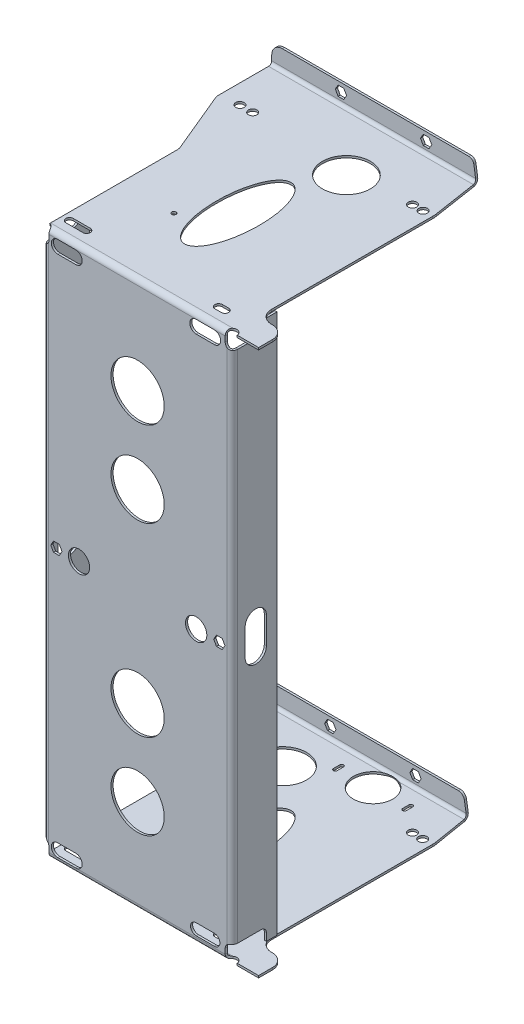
SolidWorks part; units mm, degrees
ref_plane "Plan1" through (0, 0, 0) normal (0, 0, 1) x (1, 0, 0)
ref_plane "Plan2" through (0, 0, 0) normal (0, 1, 0) x (1, 0, 0)
ref_plane "Plan3" through (0, 0, 0) normal (1, 0, 0) x (0, 0, -1)
sketch "Esquisse1" plane through (0, 0, 0) normal (0, 0, 1) x (1, 0, 0)
  line L0 (117.213, -14.3145) -> (127.213, -14.3145)
  line L1 (-86.787, 108.6855) -> (-86.787, -10.8145)
  line L2 (73.3652, 240.6855) -> (-101.787, 240.6855)
  line L3 (77.9584, 236.7456) -> (86.9132, 178.6025)
  line L4 (-126.787, -14.3145) -> (-116.787, -14.3145)
  line L5 (-126.787, -14.3145) -> (-126.787, -127.1723)
  line L6 (-116.787, -521.3145) -> (-126.787, -521.3145)
  line L7 (79.0767, -761.5484) -> (86.9295, -713.7869)
  line L8 (73.463, -766.3145) -> (-101.787, -766.3145)
  line L9 (-86.787, -636.3145) -> (-86.787, -524.8145)
  line L10 (127.213, -521.3145) -> (117.213, -521.3145)
  line L11 (127.213, -14.3145) -> (127.213, -521.3145)
  line L12 (66.213, -532.8145) -> (60.213, -532.8145)
  line L13 (66.213, -539.8145) -> (60.213, -539.8145)
  line L14 (87.213, 174.6855) -> (87.213, 23.1855)
  line L15 (87.213, -710.3145) -> (87.213, -558.8145)
  line L16 (-63.787, -532.8145) -> (-79.787, -532.8145)
  line L17 (-63.787, -539.8145) -> (-79.787, -539.8145)
  line L18 (47.463, -725.3145) -> (47.463, -731.3145)
  line L19 (43.963, -725.3145) -> (43.963, -731.3145)
  line L20 (-17.537, -725.3145) -> (-17.537, -731.3145)
  line L21 (-21.037, -725.3145) -> (-21.037, -731.3145)
  line L22 (74.0572, -263.7145) -> (71.4014, -268.3145)
  line L23 (71.4014, -268.3145) -> (74.0572, -272.9145)
  line L24 (74.0572, -272.9145) -> (79.3689, -272.9145)
  line L25 (79.3689, -272.9145) -> (82.0247, -268.3145)
  line L26 (-79.787, -2.8145) -> (-63.787, -2.8145)
  line L27 (-79.787, 4.1855) -> (-63.787, 4.1855)
  line L28 (-111.787, -756.3145) -> (-111.787, -696.3145)
  line L29 (-110.9107, -692.2208) -> (-87.6632, -640.4081)
  line L30 (-111.787, 230.6855) -> (-111.787, 172.6855)
  line L31 (-44.1311, 228.0855) -> (-41.4753, 232.6855)
  line L32 (-41.4753, 232.6855) -> (-44.1311, 237.2855)
  line L33 (-44.1311, 237.2855) -> (-49.4428, 237.2855)
  line L34 (-49.4428, 237.2855) -> (-52.0986, 232.6855)
  line L35 (-52.0986, 232.6855) -> (-49.4428, 228.0855)
  line L36 (-49.4428, 228.0855) -> (-44.1311, 228.0855)
  line L37 (35.8689, 228.0855) -> (38.5247, 232.6855)
  line L38 (38.5247, 232.6855) -> (35.8689, 237.2855)
  line L39 (35.8689, 237.2855) -> (30.5572, 237.2855)
  line L40 (30.5572, 237.2855) -> (27.9014, 232.6855)
  line L41 (27.9014, 232.6855) -> (30.5572, 228.0855)
  line L42 (30.5572, 228.0855) -> (35.8689, 228.0855)
  line L43 (-44.1311, -762.9145) -> (-41.4753, -758.3145)
  line L44 (-41.4753, -758.3145) -> (-44.1311, -753.7145)
  line L45 (-44.1311, -753.7145) -> (-49.4428, -753.7145)
  line L46 (-49.4428, -753.7145) -> (-52.0986, -758.3145)
  line L47 (-52.0986, -758.3145) -> (-49.4428, -762.9145)
  line L48 (-49.4428, -762.9145) -> (-44.1311, -762.9145)
  line L49 (35.8689, -762.9145) -> (38.5247, -758.3145)
  line L50 (38.5247, -758.3145) -> (35.8689, -753.7145)
  line L51 (35.8689, -753.7145) -> (30.5572, -753.7145)
  line L52 (30.5572, -753.7145) -> (27.9014, -758.3145)
  line L53 (27.9014, -758.3145) -> (30.5572, -762.9145)
  line L54 (30.5572, -762.9145) -> (35.8689, -762.9145)
  line L55 (-111.0177, 168.8394) -> (-87.5562, 112.5317)
  line L56 (60.213, -2.8145) -> (66.213, -2.8145)
  line L57 (60.213, 4.1855) -> (66.213, 4.1855)
  line L58 (82.0247, -268.3145) -> (79.3689, -263.7145)
  line L59 (79.3689, -263.7145) -> (74.0572, -263.7145)
  line L60 (-81.5986, -268.3145) -> (-78.9428, -272.9145)
  line L61 (-78.9428, -272.9145) -> (-73.6311, -272.9145)
  line L62 (-73.6311, -272.9145) -> (-70.9753, -268.3145)
  line L63 (-70.9753, -268.3145) -> (-73.6311, -263.7145)
  line L64 (-73.6311, -263.7145) -> (-78.9428, -263.7145)
  line L65 (-78.9428, -263.7145) -> (-81.5986, -268.3145)
  line L66 (-126.787, -155.4566) -> (-126.787, -382.1723)
  line L67 (-126.787, -410.4566) -> (-126.787, -521.3145)
  line L68 (99.213, -546.8145) -> (100.213, -546.8145)
  line L69 (112.213, -534.8145) -> (112.213, -521.8145)
  line L70 (-116.787, -521.3145) -> (-116.787, -514.3145)
  line L71 (-111.787, -509.3145) -> (-88.287, -509.3145)
  line L72 (82.213, -14.3145) -> (82.213, -21.3145)
  line L73 (87.213, -26.3145) -> (112.213, -26.3145)
  line L74 (117.213, -21.3145) -> (117.213, -14.3145)
  line L75 (92.188, -13.8145) -> (112.213, -13.8145)
  line L76 (112.213, -13.8145) -> (112.213, -0.8145)
  line L77 (100.213, 11.1855) -> (99.213, 11.1855)
  line L78 (-83.287, -14.3145) -> (-83.287, -21.3145)
  line L79 (-88.287, -26.3145) -> (-111.787, -26.3145)
  line L80 (-116.787, -21.3145) -> (-116.787, -14.3145)
  line L81 (-83.287, -521.3145) -> (-83.287, -514.3145)
  line L82 (112.213, -521.8145) -> (92.188, -521.8145)
  line L83 (82.213, -521.3145) -> (82.213, -514.3145)
  line L84 (87.213, -509.3145) -> (112.213, -509.3145)
  line L85 (117.213, -514.3145) -> (117.213, -521.3145)
  arc A0 (-111.787, 230.6855) -> (-101.787, 240.6855) centre (-101.787, 230.6855) cw
  arc A1 (-111.0177, 168.8394) -> (-111.787, 172.6855) centre (-101.787, 172.6855) cw
  circle A2 centre (-46.787, -758.3145) radius 4.6 construction
  circle A3 centre (33.213, -758.3145) radius 4.6 construction
  arc A4 (-86.787, 108.6855) -> (-87.5562, 112.5317) centre (-96.787, 108.6855) ccw
  arc A5 (-101.787, -766.3145) -> (-111.787, -756.3145) centre (-101.787, -756.3145) cw
  arc A6 (-83.287, -14.3145) -> (-86.787, -10.8145) centre (-86.787, -14.3145) ccw
  arc A7 (73.463, -766.3145) -> (79.0767, -761.5484) centre (73.463, -760.6254) ccw
  arc A8 (77.9584, 236.7456) -> (73.3652, 240.6855) centre (73.3652, 236.0381) ccw
  arc A9 (87.213, 174.6855) -> (86.9132, 178.6025) centre (61.4802, 174.6855) ccw
  arc A10 (86.9295, -713.7869) -> (87.213, -710.3145) centre (65.8096, -710.3145) ccw
  arc A11 (-86.787, -524.8145) -> (-83.287, -521.3145) centre (-86.787, -521.3145) ccw
  arc A12 (-111.787, -696.3145) -> (-110.9107, -692.2208) centre (-101.787, -696.3145) cw
  arc A13 (-86.787, -636.3145) -> (-87.6632, -640.4081) centre (-96.787, -636.3145) cw
  circle A14 centre (-46.787, 232.6855) radius 4.6 construction
  circle A15 centre (33.213, 232.6855) radius 4.6 construction
  circle A16 centre (13.213, -728.3145) radius 18.5
  arc A17 (92.188, -13.8145) -> (82.213, -14.3145) centre (87.213, -14.3145) ccw
  circle A18 centre (-46.787, -703.3145) radius 22.5
  arc A19 (82.213, -521.3145) -> (92.188, -521.8145) centre (87.213, -521.3145) ccw
  circle A20 centre (78.213, -709.9145) radius 4
  circle A21 centre (-81.787, -709.9145) radius 4
  arc A22 (66.213, -539.8145) -> (66.213, -532.8145) centre (66.213, -536.3145) ccw
  arc A23 (60.213, -532.8145) -> (60.213, -539.8145) centre (60.213, -536.3145) ccw
  arc A24 (-63.787, -539.8145) -> (-63.787, -532.8145) centre (-63.787, -536.3145) ccw
  arc A25 (-79.787, -532.8145) -> (-79.787, -539.8145) centre (-79.787, -536.3145) ccw
  circle A26 centre (-46.787, -621.3145) radius 2.5
  arc A27 (-17.537, -725.3145) -> (-21.037, -725.3145) centre (-19.287, -725.3145) ccw
  circle A28 centre (-93.787, -709.9145) radius 4
  arc A29 (-21.037, -731.3145) -> (-17.537, -731.3145) centre (-19.287, -731.3145) ccw
  arc A30 (47.463, -725.3145) -> (43.963, -725.3145) centre (45.713, -725.3145) ccw
  arc A31 (43.963, -731.3145) -> (47.463, -731.3145) centre (45.713, -731.3145) ccw
  circle A32 centre (-46.787, -591.3145) radius 2
  circle A33 centre (13.213, 167.6855) radius 22.5
  circle A34 centre (-93.787, 174.6855) radius 4
  circle A35 centre (78.213, 174.6855) radius 4
  circle A36 centre (-81.787, 174.6855) radius 4
  circle A37 centre (76.713, -268.3145) radius 4.6 construction
  circle A38 centre (-76.287, -268.3145) radius 4.6 construction
  arc A39 (-126.787, -155.4566) -> (-126.787, -127.1723) centre (-131.787, -141.3145) ccw
  arc A40 (-126.787, -410.4566) -> (-126.787, -382.1723) centre (-131.787, -396.3145) ccw
  circle A41 centre (-36.787, 55.6855) radius 2
  arc A42 (-79.787, 4.1855) -> (-79.787, -2.8145) centre (-79.787, 0.6855) ccw
  arc A43 (-63.787, -2.8145) -> (-63.787, 4.1855) centre (-63.787, 0.6855) ccw
  arc A44 (60.213, 4.1855) -> (60.213, -2.8145) centre (60.213, 0.6855) ccw
  arc A45 (66.213, -2.8145) -> (66.213, 4.1855) centre (66.213, 0.6855) ccw
  arc A46 (-83.287, -514.3145) -> (-88.287, -509.3145) centre (-88.287, -514.3145) ccw
  arc A47 (-88.287, -26.3145) -> (-83.287, -21.3145) centre (-88.287, -21.3145) ccw
  circle A48 centre (-71.787, -621.3145) radius 2.5
  arc A49 (87.213, -26.3145) -> (82.213, -21.3145) centre (87.213, -21.3145) cw
  arc A50 (117.213, -21.3145) -> (112.213, -26.3145) centre (112.213, -21.3145) cw
  arc A51 (99.213, 11.1855) -> (87.213, 23.1855) centre (99.213, 23.1855) cw
  arc A52 (100.213, 11.1855) -> (112.213, -0.8145) centre (100.213, -0.8145) cw
  arc A53 (-111.787, -26.3145) -> (-116.787, -21.3145) centre (-111.787, -21.3145) cw
  arc A54 (-116.787, -514.3145) -> (-111.787, -509.3145) centre (-111.787, -514.3145) cw
  arc A55 (100.213, -546.8145) -> (112.213, -534.8145) centre (100.213, -534.8145) ccw
  arc A56 (87.213, -558.8145) -> (99.213, -546.8145) centre (99.213, -558.8145) cw
  arc A57 (82.213, -514.3145) -> (87.213, -509.3145) centre (87.213, -514.3145) cw
  arc A58 (117.213, -514.3145) -> (112.213, -509.3145) centre (112.213, -514.3145) ccw
  circle A59 centre (68.213, 174.6855) radius 4
  circle A60 centre (68.213, -710.3145) radius 4
  ellipse E0 centre (-6.787, -621.3145) end of major axis (-6.787, -671.3145) minor radius 20
  ellipse E1 centre (-6.787, 85.6855) end of major axis (-6.787, 35.6855) minor radius 20
  point P21 (-111.787, 240.6855)
  point P34 (-86.787, 240.6855)
  point P35 (-86.787, 240.6855)
  point P37 (-111.787, 170.6855)
  point P44 (-86.787, 110.6855)
  point P90 (60.4704, -596.9343)
  point P220 (82.213, -509.3145)
  point P223 (117.213, -509.3145)
  dimension "D5" = 25
  dimension "D6" = 189
  dimension "D4" = 10
  dimension "D13" = 245
  dimension "D17" = 9.2
  dimension "D18" = 60
  dimension "D20" = 10
  dimension "D19" = 15
  dimension "D22" = 10
  dimension "D32" = 3.5
  dimension "D33" = 174
  dimension "D34" = 174
  dimension "D36" = 7
  dimension "D39" = 16
  dimension "D40" = 10
  dimension "D43" = 85
  dimension "D44" = 10
  dimension "D23" = 37
  dimension "D25" = 45
  dimension "D26" = 8
  dimension "D49" = 5
  dimension "D51" = 1.75
  dimension "D55" = 4
  dimension "D56" = 45
  dimension "D58" = 8
  dimension "D61" = 40
  dimension "D67" = 4
  dimension "D72" = 30
  dimension "D76" = 182
  dimension "D99" = 74
  dimension "D100" = 182
  dimension "D102" = 60
  dimension "D103" = 5
  dimension "D107" = 12
  dimension "D81" = 146
  dimension "D111" = 12
  dimension "D112" = 5
  dimension "D114" = 12
  dimension "D116" = 30
  dimension "D117" = 9
  dimension "D106" = 5
  dimension "D83" = 146
  dimension "D120" = 12
  dimension "D125" = 5
  dimension "D128" = 10
  dimension "D129" = 10
  dimension "D7" = 70
  dimension "D9" = 507
  dimension "D10" = 80
  dimension "D11" = 40
  dimension "D12" = 507
  dimension "D14" = 175.1521
  dimension "D15" = 8
  dimension "D16" = 8
  dimension "D21" = 40
  dimension "D24" = 70
  dimension "D27" = 80
  dimension "D28" = 9.2
  dimension "D29" = 9.2
  dimension "D30" = 9.2
  dimension "D31" = 60
  dimension "D35" = 255
  dimension "D37" = 160
  dimension "D38" = 6
  dimension "D41" = 40
  dimension "D42" = 100
  dimension "D45" = 85
  dimension "D46" = 173.6
  dimension "D47" = 12
  dimension "D48" = 25
  dimension "D50" = 6
  dimension "D52" = 65
  dimension "D53" = 32.5
  dimension "D54" = 3
  dimension "D57" = 153
  dimension "D59" = 50.5
  dimension "D60" = 16
  dimension "D62" = 254
  dimension "D63" = 40
  dimension "D64" = 100
  dimension "D65" = 254
  dimension "D66" = 12
  dimension "D68" = 40
  dimension "D69" = 40
  dimension "D70" = 9.2
  dimension "D71" = 9.2
  dimension "D73" = 255
  dimension "D74" = 127
  dimension "D75" = 5
  dimension "D77" = 15
  dimension "D78" = 15
  dimension "D79" = 15
  dimension "D80" = 7
  dimension "D82" = 7
  dimension "D84" = 160
  dimension "D85" = 18
  dimension "D86" = 189
  dimension "D87" = 18
  dimension "D88" = 199
  dimension "D89" = 199
  dimension "D90" = 80
  dimension "D91" = 100
  dimension "D92" = 80
  dimension "D93" = 100
  dimension "D94" = 70
  dimension "D95" = 50
  dimension "D96" = 40
  dimension "D97" = 70
  dimension "D98" = 30
  dimension "D101" = 40
  dimension "D104" = 12
  dimension "D105" = 30
  dimension "D108" = 30
  dimension "D109" = 25
  dimension "D110" = 6
  dimension "D113" = 0.5
  dimension "D115" = 25
  dimension "D118" = 25
  dimension "D119" = 0.5
  dimension "D121" = 25
  dimension "D122" = 25
  dimension "D123" = 12
  dimension "D124" = 30
  dimension "D126" = 7
  dimension "D127" = 7
extrude "Base-Extrusion" add sketch "Esquisse1" along normal blind 2
sheet metal parameters "Tôlerie 1" parameters "D1"=3
flatten bends "Dépliage 1" parameters "D1"=0
sketch "Esquisse-Angle1" plane through (0, 0, 2) normal (0, 0, 1) x (1, 0, 0)
process bends "Pliage 1" parameters "D1"=3
sketch "Esquisse-Plate1" plane through (0, 0, 2) normal (0, 0, 1) x (1, 0, 0)
  line L4 (-88.5289, -13.3145) -> (89.1171, -13.3145) construction
  line L6 (87.113, -17.1915) -> (87.113, -519.4237) construction
  line L10 (-86.887, -12.0311) -> (-86.887, -521.9341) construction
  line L11 (-126.787, -14.3145) -> (-116.787, -14.3145) construction
  line L12 (-86.787, 108.6855) -> (-86.787, -10.8145) construction
  line L13 (-91.2972, -522.3145) -> (89.3496, -522.3145) construction
  line L14 (-116.787, -521.3145) -> (-126.787, -521.3145) construction
  line L15 (-116.787, -521.3145) -> (-126.787, -521.3145) construction
  line L16 (-114.6521, 222.6855) -> (97.6807, 222.6855) construction
  line L20 (73.3652, 240.6855) -> (-101.787, 240.6855) construction
  line L21 (-121.9113, -748.3145) -> (109.7794, -748.3145) construction
  line L22 (73.463, -766.3145) -> (-101.787, -766.3145) construction
  line L25 (-126.787, -14.3145) -> (-126.787, -127.1723) construction
  point P0 (-0.5594, -46.4639)
  dimension "D1" = 1
  dimension "D2" = 0.1
  dimension "D3" = 174
  dimension "D4" = 1
  dimension "D5" = 18
  dimension "D6" = 18
  dimension "D7" = 39.9
bend "Pli défini à plat24" bend radius 3 bend angle 90 parameters "D5"=1
bend "Pli défini à plat25" bend radius 3 bend angle 90 parameters "D5"=2
bend "Pli défini à plat26" bend radius 3 bend angle 90 parameters "D5"=3
bend "Pli défini à plat28" bend radius 3 bend angle 90 parameters "D5"=4
bend "Pli défini à plat29" bend radius 3 bend angle 90 parameters "D5"=5
bend "Pli défini à plat30" bend radius 3 bend angle 90 parameters "D5"=6
sketch "Esquisse2" plane through (0, 495.5314, 0) normal (0, 0, -1) x (1, 0, 0)
  line L0 (88.9715, 1004.8459) -> (88.9715, 521.8459) construction
  line L1 (-88.7454, 650.988) -> (-88.7454, 877.7037) construction
  line L2 (88.9715, 509.8459) -> (88.9715, 1016.8459) construction
  line L4 (54.9715, 1013.2975) -> (71.9715, 1013.2975)
  line L6 (54.9715, 1002.7043) -> (71.9715, 1002.7043)
  line L8 (-75.0285, 1014.7043) -> (-58.0285, 1014.7043)
  line L10 (-75.0285, 1002.7043) -> (-58.0285, 1002.7043)
  line L11 (-75.0285, 523.9874) -> (-58.0285, 523.9874)
  line L13 (-75.0285, 511.9874) -> (-58.0285, 511.9874)
  line L15 (54.9715, 523.9874) -> (71.9715, 523.9874)
  line L17 (54.9715, 511.9874) -> (71.9715, 511.9874)
  line L23 (-86.787, 1019.7043) -> (84.4118, 1019.7043) construction
  line L24 (-111.0177, 508.9874) -> (-87.5562, 508.9874) construction
  line L25 (-110.9107, 1017.7043) -> (-87.6632, 1017.7043) construction
  circle A0 centre (-0.0285, 931.7043) radius 25
  circle A1 centre (-0.0285, 851.7043) radius 25
  circle A2 centre (-0.0285, 677.7043) radius 25
  circle A3 centre (-0.0285, 597.7043) radius 25
  arc A4 (71.9715, 1013.2975) -> (71.9715, 1002.7043) centre (71.9715, 1008.0009) cw
  arc A5 (54.9715, 1002.7043) -> (54.9715, 1013.2975) centre (54.9715, 1008.0009) cw
  arc A6 (-58.0285, 1014.7043) -> (-58.0285, 1002.7043) centre (-58.0285, 1008.7043) cw
  arc A7 (-75.0285, 1014.7043) -> (-75.0285, 1002.7043) centre (-75.0285, 1008.7043) ccw
  arc A8 (71.9715, 523.9874) -> (71.9715, 511.9874) centre (71.9715, 517.9874) cw
  arc A9 (54.9715, 511.9874) -> (54.9715, 523.9874) centre (54.9715, 517.9874) cw
  arc A10 (-58.0285, 523.9874) -> (-58.0285, 511.9874) centre (-58.0285, 517.9874) cw
  arc A11 (-75.0285, 523.9874) -> (-75.0285, 511.9874) centre (-75.0285, 517.9874) ccw
  circle A12 centre (-55.0285, 763.8459) radius 10
  circle A13 centre (54.9715, 763.8459) radius 10
  point P11 (-81.8584, 683.7752)
  dimension "D1" = 50
  dimension "D2" = 80
  dimension "D3" = 80
  dimension "D4" = 174
  dimension "D5" = 88
  dimension "D7" = 3
  dimension "D12" = 20
  dimension "D13" = 110
  dimension "D15" = 55
  dimension "D21" = 17
  dimension "D6" = 3
  dimension "D8" = 17
  dimension "D9" = 17
  dimension "D10" = 12
  dimension "D11" = 113
  dimension "D14" = 12
  dimension "D16" = 113
  dimension "D17" = 88.7168
  dimension "D18" = 89
  dimension "D19" = 17
  dimension "D20" = 17
extrude "Enlèv. mat.-Extru.1" cut sketch "Esquisse2" against normal blind 10
sketch "Esquisse3" plane through (88.9715, 0, 0) normal (1, 0, 0) x (0, 0, -1)
  line L0 (29.9584, -255.8145) -> (29.9584, -280.8145)
  line L1 (9.9584, -255.8145) -> (9.9584, -280.8145)
  line L3 (-2, -268.3145) -> (0, -268.3145) construction
  line L5 (39.9584, -14.3145) -> (39.9584, -521.3145) construction
  arc A0 (29.9584, -255.8145) -> (9.9584, -255.8145) centre (19.9584, -255.8145) ccw
  arc A1 (9.9584, -280.8145) -> (29.9584, -280.8145) centre (19.9584, -280.8145) ccw
  dimension "D2" = 10
  dimension "D1" = 25
  dimension "D3" = 10
  dimension "D4" = 12.5
extrude "Enlèv. mat.-Extru.2" cut sketch "Esquisse3" against normal through all
